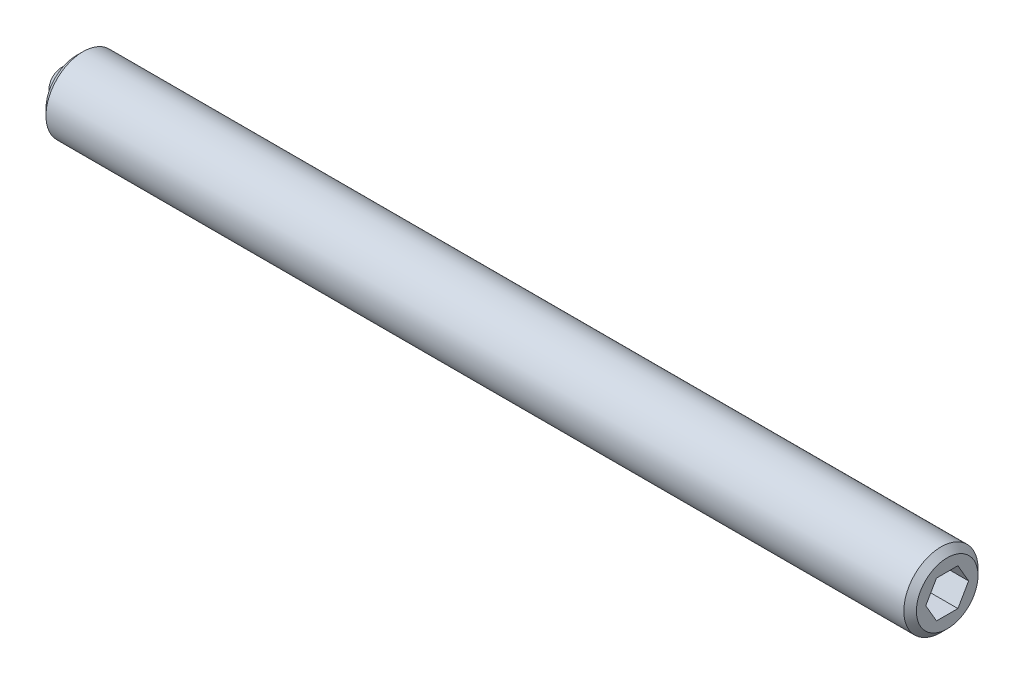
SolidWorks part; units mm, degrees
ref_plane "Front Plane" through (0, 0, 0) normal (0, 0, 1) x (1, 0, 0)
ref_plane "Top Plane" through (0, 0, 0) normal (0, 1, 0) x (1, 0, 0)
ref_plane "Right Plane" through (0, 0, 0) normal (1, 0, 0) x (0, 0, -1)
sketch "Sketch2" plane through (0, 0, 0) normal (1, 0, 0) x (0, 0, -1)
  circle A0 centre (0, 0) radius 1.5
  dimension "D1" = 3
extrude "Boss-Extrude1" add sketch "Sketch2" along normal blind 35.2
sketch "Sketch3" plane through (0, 0, 0) normal (-1, 0, 0) x (0, 0, 1)
  circle A0 centre (0, 0) radius 0.8
  dimension "D1" = 1.6
chamfer "Chamfer1" distance 0.254 angle 45 1 edges at (0, 0, -1.5)
chamfer "Chamfer2" distance 0.254 angle 45 1 edges at (35.2, 0, -1.5)
sketch "Sketch4" plane through (35.2, 0, 0) normal (1, 0, 0) x (0, 0, -1)
  line L1 (0.866, 0) -> (0.433, 0.75)
  line L2 (0.433, 0.75) -> (-0.433, 0.75)
  line L3 (-0.433, 0.75) -> (-0.866, 0)
  line L4 (-0.866, 0) -> (-0.433, -0.75)
  line L5 (-0.433, -0.75) -> (0.433, -0.75)
  line L6 (0.433, -0.75) -> (0.866, 0)
  circle A0 centre (0, 0) radius 0.75 construction
  dimension "D1" = 1.5
extrude "Cut-Extrude2" cut sketch "Sketch4" against normal blind 2
extrude "Cut-Extrude3" cut sketch "Sketch3" against normal blind 0.8
sketch "Sketch5" plane through (0, 0, 0) normal (-1, 0, 0) x (0, 0, 1)
  line L0 (0, 0) -> (0, -0.8)
  line L1 (0, 0) -> (0, 0.8)
  arc A0 (0, 0.8) -> (0, -0.8) centre (0, 0) ccw
  dimension "D1" = 0.8
revolve "Revolve1" add sketch "Sketch5" angle 360 about L1
